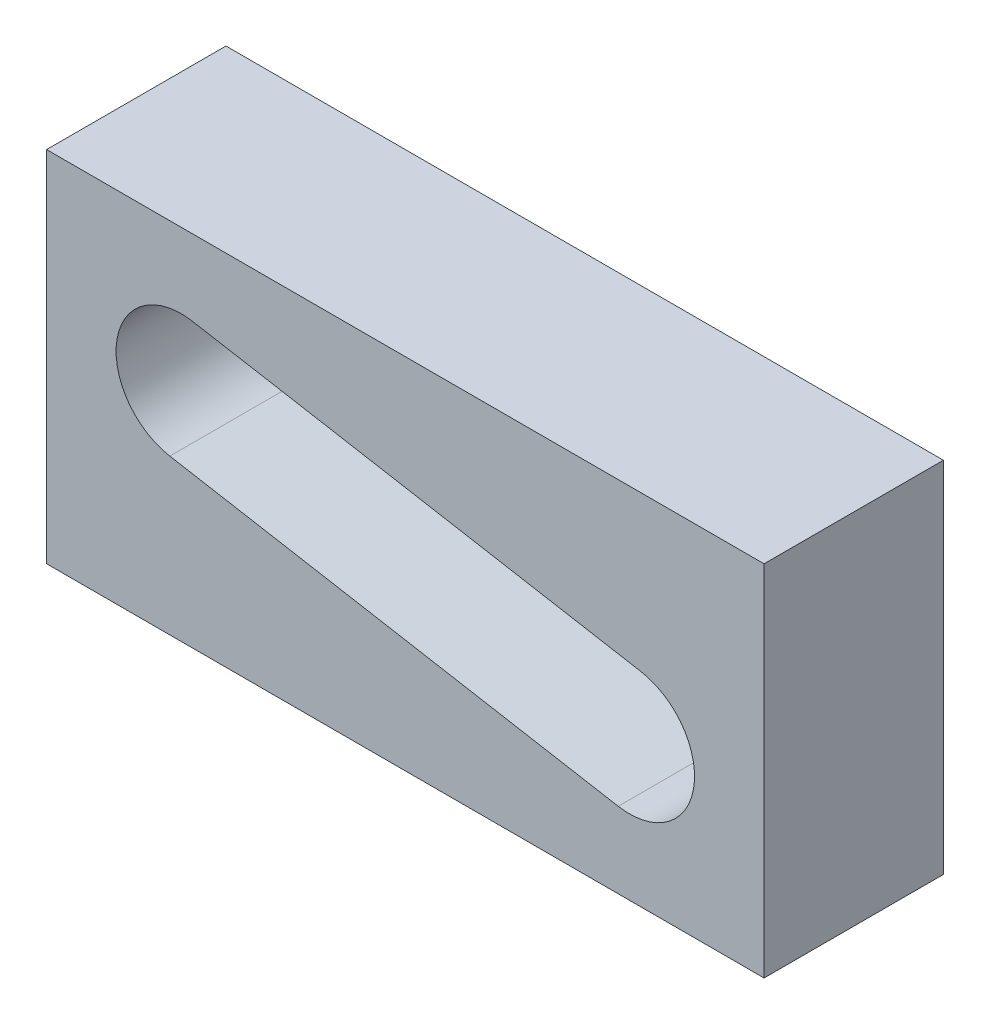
SolidWorks part; units mm, degrees
ref_plane "Front Plane" through (0, 0, 0) normal (0, 0, 1) x (1, 0, 0)
ref_plane "Top Plane" through (0, 0, 0) normal (0, 1, 0) x (1, 0, 0)
ref_plane "Right Plane" through (0, 0, 0) normal (1, 0, 0) x (0, 0, -1)
sketch "Sketch1" plane through (0, 0, 0) normal (0, 0, 1) x (1, 0, 0)
  line L0 (1.5, 2.4408) -> (6.5, 1.5592) construction
  line L1 (0, 0) -> (8, 0)
  line L2 (0, 0) -> (0, 4)
  line L3 (0, 4) -> (8, 4)
  line L4 (8, 0) -> (8, 4)
  line L5 (1.6259, 3.1548) -> (6.6259, 2.2732)
  line L6 (1.3741, 1.7268) -> (6.3741, 0.8452)
  arc A0 (1.6259, 3.1548) -> (1.3741, 1.7268) centre (1.5, 2.4408) ccw
  arc A1 (6.3741, 0.8452) -> (6.6259, 2.2732) centre (6.5, 1.5592) ccw
  point P7 (4, 2)
  point P15 (0, 2)
  point P17 (4, 4)
  dimension "D3" = 0.725
  dimension "D1" = 8
  dimension "D2" = 4
  dimension "D4" = 10
  dimension "D5" = 1.5
extrude "Boss-Extrude1" add sketch "Sketch1" along normal blind 2
equation "\"thkness\"= 2mm"
equation "\"size\"= 65mm"
equation "\"side_len\"= \"size\" / (2 * sin ( 60 ) )"
equation "\"D1@Boss-Extrude1\"=\"thkness\""
